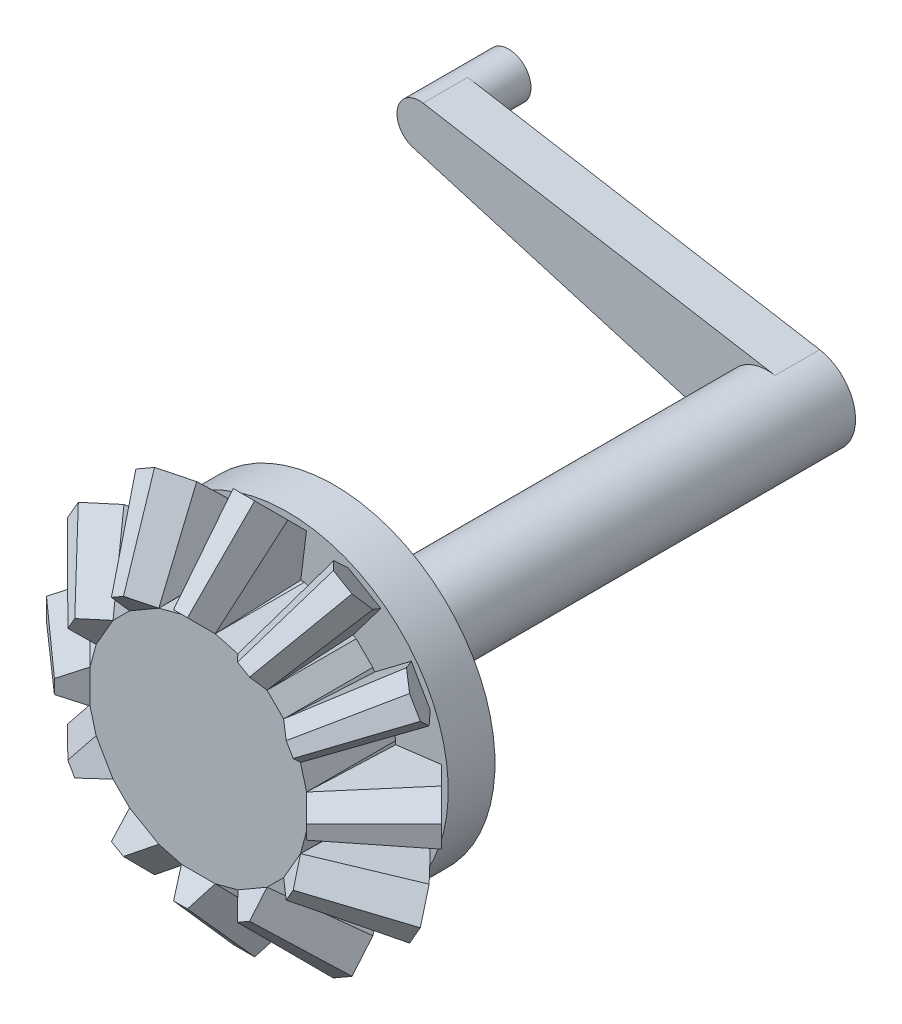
SolidWorks part; units mm, degrees
ref_plane "Plane1" through (0, 0, 0) normal (0, 0, 1) x (1, 0, 0)
ref_plane "Plane2" through (0, 0, 0) normal (0, 1, 0) x (1, 0, 0)
ref_plane "Plane3" through (0, 0, 0) normal (1, 0, 0) x (0, 0, -1)
imported_body "Imported1"
scale "Scale1" scale about centroid uniform scaling yes scale factor 0.97
sketch "Sketch1" plane through (0, 0, -91.7286) normal (0, 0, -1) x (-1, 0, 0)
  line L0 (-2.1315, 12.1332) -> (97.9276, 29.1353)
  line L1 (3.408, -11.8382) -> (100.8512, 16.8035)
  arc A0 (97.9276, 29.1353) -> (100.8512, 16.8035) centre (98.9914, 22.8751) cw
  circle A1 centre (0, 0) radius 12.319
  arc A2 (-2.1315, 12.1332) -> (3.408, -11.8382) centre (0, 0) ccw
  dimension "D3" = 6.35
  dimension "D2" = 101.6
  dimension "D1" = 0
extrude "Boss-Extrude1" add sketch "Sketch1" along normal blind 12.7
sketch "Sketch3" plane through (0, 0, -104.4286) normal (0, 0, -1) x (-1, 0, 0)
  circle A0 centre (98.9914, 22.8751) radius 6.35
  arc A1 (100.8512, 16.8035) -> (97.9276, 29.1353) centre (98.9914, 22.8751) ccw construction
extrude "Boss-Extrude2" add sketch "Sketch3" along normal blind 12.7
